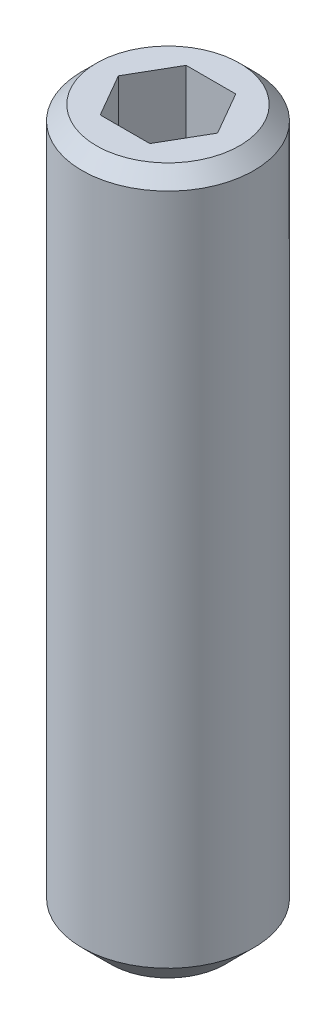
SolidWorks part; units mm, degrees
ref_plane "Plane1" through (0, 0, 0) normal (0, 0, 1) x (1, 0, 0)
ref_plane "Plane2" through (0, 0, 0) normal (0, 1, 0) x (1, 0, 0)
ref_plane "Plane3" through (0, 0, 0) normal (1, 0, 0) x (0, 0, -1)
sketch "Esquisse1" plane through (0, 0, 0) normal (0, 1, 0) x (1, 0, 0)
  circle A0 centre (0, 0) radius 3
  dimension "D1" = 6
extrude "Longueur filté" add sketch "Esquisse1" along normal blind 25
chamfer "Chanfrein1" distance 0.5 angle 45 1 edges at (0, 25, 3)
sketch "Esquisse6" plane through (0, 25, 0) normal (0, -1, 0) x (-1, 0, 0)
  line L1 (1.7321, 0) -> (0.866, 1.5)
  line L2 (0.866, 1.5) -> (-0.866, 1.5)
  line L3 (-0.866, 1.5) -> (-1.7321, 0)
  line L4 (-1.7321, 0) -> (-0.866, -1.5)
  line L5 (-0.866, -1.5) -> (0.866, -1.5)
  line L6 (0.866, -1.5) -> (1.7321, 0)
  circle A0 centre (0, 0) radius 1.5 construction
  dimension "S" = 3
extrude "Enlèv. mat.-Extru.4" cut sketch "Esquisse6" along normal blind 3.5
sketch "Esquisse7" plane through (0, 0, 0) normal (0, -1, 0) x (1, 0, 0)
  circle A0 centre (0, 0) radius 2
  dimension "Dz" = 4
extrude "Enlèv. mat.-Extru.6" cut sketch "Esquisse7" against normal through all draft 45 flip side to cut
equation "\"Ch@Chanfrein1\" = (\"D1@Esquisse1\"-\"D2@Représentation de filetage1\")/2"
